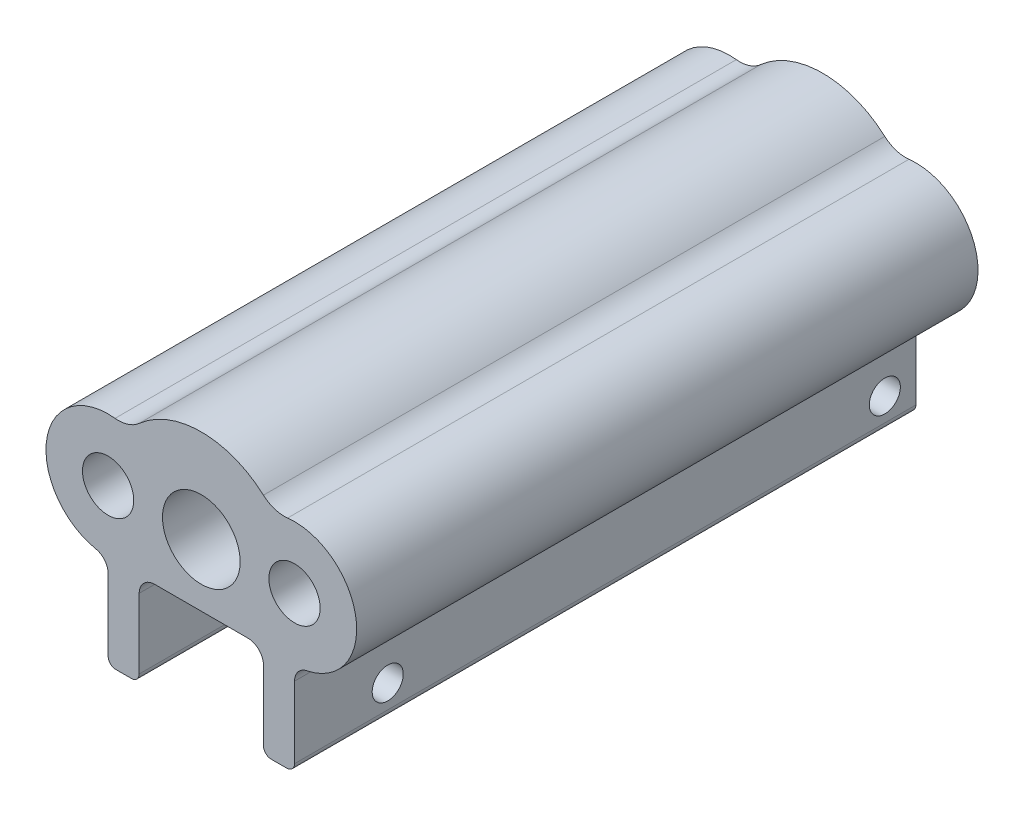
SolidWorks part; units mm, degrees
ref_plane "前视基准面" through (0, 0, 0) normal (0, 0, 1) x (1, 0, 0)
ref_plane "上视基准面" through (0, 0, 0) normal (0, 1, 0) x (1, 0, 0)
ref_plane "右视基准面" through (0, 0, 0) normal (1, 0, 0) x (0, 0, -1)
sketch "草图1" plane through (0, 0, 0) normal (0, 0, 1) x (1, 0, 0)
  arc A0 (-4.6667, -3.7712) -> (4.6667, -3.7712) centre (0, 0) ccw
  arc A1 (-4.6667, 3.7712) -> (-4.6667, -3.7712) centre (-6, 0) ccw
  arc A2 (4.6667, -3.7712) -> (4.6667, 3.7712) centre (6, 0) ccw
  arc A3 (4.6667, 3.7712) -> (-4.6667, 3.7712) centre (0, 0) ccw
  dimension "D1" = 6
  dimension "D2" = 6
  dimension "D3" = 12
  dimension "D4" = 8
  dimension "D5" = 8
extrude "凸台-拉伸1" add sketch "草图1" along normal blind 40
fillet "圆角1" radius 2 2 edges at (4.6667, 3.7712, 20) (-4.6667, 3.7712, 20)
sketch "草图2" plane through (0, 0, 40) normal (0, 0, 1) x (1, 0, 0)
  circle A0 centre (-6, 0) radius 1.6
  circle A1 centre (6, 0) radius 1.5
  circle A2 centre (0, 0) radius 2.5
  dimension "D1" = 3.2
  dimension "D2" = 3
  dimension "D3" = 5
extrude "切除-拉伸2" cut sketch "草图2" against normal up to surface (40 mm away)
sketch "草图4" plane through (0, 0, 40) normal (0, 0, 1) x (1, 0, 0)
  line L1 (-6, -3) -> (6, -3)
  line L2 (-6, -3) -> (-6, -10)
  line L3 (-6, -10) -> (6, -10)
  line L4 (6, -3) -> (6, -10)
  circle A0 centre (0, 0) radius 2.5 construction
  dimension "D1" = 6
  dimension "D2" = 6
  dimension "D3" = 7
  dimension "D4" = 10
extrude "凸台-拉伸2" add sketch "草图4" against normal up to surface (40 mm away)
sketch "草图5" plane through (0, 0, 40) normal (0, 0, 1) x (1, 0, 0)
  line L0 (6, -10) -> (6, -4) construction
  line L1 (-4, -4) -> (4, -4)
  line L2 (-4, -4) -> (-4, -10.8533)
  line L3 (-4, -10.8533) -> (4, -10.8533)
  line L4 (4, -4) -> (4, -10.8533)
  line L5 (-6, -4) -> (-6, -10) construction
  circle A0 centre (0, 0) radius 2.5 construction
  dimension "D1" = 2
  dimension "D2" = 2
  dimension "D3" = 4
extrude "切除-拉伸3" cut sketch "草图5" against normal blind 40
fillet "圆角3" radius 1 2 edges at (-6, -4, 20) (6, -4, 20)
fillet "圆角4" radius 1 2 edges at (-4, -4, 20) (4, -4, 20)
fillet "圆角5" radius 0.5 4 edges at (-4, -10, 20) (-6, -10, 20) (4, -10, 20) (6, -10, 20)
sketch "草图6" plane through (-6, 0, 0) normal (-1, 0, 0) x (0, 0, 1)
  line L1 (40, -4.899) -> (40, -9.5) construction
  line L2 (0, -9.5) -> (0, -4.899) construction
  line L3 (40, -10) -> (0, -10) construction
  circle A0 centre (2, -8) radius 1
  circle A1 centre (34, -8) radius 1
  dimension "D1" = 2
  dimension "D2" = 2
  dimension "D3" = 6
  dimension "D4" = 2
  dimension "D5" = 2
  dimension "D6" = 2
extrude "切除-拉伸4" cut sketch "草图6" against normal through all
hole_wizard "M4 螺纹孔1" positions "3D草图1" profile "草图7" tap size "M4" standard "GB"
sketch3d "3D草图1"
  line L0 (6, 0, 0) -> (6, 0, 40) construction
  line L1 (-6, 0, 0) -> (-6, 0, 40) construction
  circle A0 centre (-6, 0, 0) radius 1.6 construction
  point P0 (6, 0, 40)
  point P4 (-6, 0, 40)
  point P12 (6, 0, 0)
  point P14 (-6, 0, 0)
  point P16 (-7.0326, -1.2222, 0)
  point P20 (-6, 0, -1.6)
sketch "草图7" plane through (6, 0, 40) normal (1, 0, 0) x (0, -1, 0)
  line L0 (0, 0) -> (0, 11.0914)
  line L1 (0, 11.0914) -> (1.65, 10.1)
  line L2 (1.65, 10.1) -> (1.65, 0)
  line L5 (1.65, 0) -> (0, 0)
  line L10 (0, 11.0914) -> (-1.65, 10.1) construction
  line L11 (0, -6.35) -> (0, 107.95) construction
  dimension "螺纹孔钻头直径" = 3.3
  dimension "螺纹孔钻头深度" = 10.1
  dimension "导头角度" = 118
sketch "草图10" plane through (0, 0, 0) normal (0, 0, -1) x (-1, 0, 0)
  point P0 (6, 0)
hole_wizard "M4 螺纹孔2" positions "3D草图4" profile "草图11" tap size "M4" standard "GB"
sketch3d "3D草图4"
  point P0 (-6, 0, 0)
sketch "草图11" plane through (-6, 0, 0) normal (1, 0, 0) x (0, 1, 0)
  line L0 (0, 0) -> (0, 11.0914)
  line L1 (0, 11.0914) -> (1.65, 10.1)
  line L2 (1.65, 10.1) -> (1.65, 0)
  line L5 (1.65, 0) -> (0, 0)
  line L10 (0, 11.0914) -> (-1.65, 10.1) construction
  line L11 (0, -6.35) -> (0, 107.95) construction
  dimension "螺纹孔钻头直径" = 3.3
  dimension "螺纹孔钻头深度" = 10.1
  dimension "导头角度" = 118
